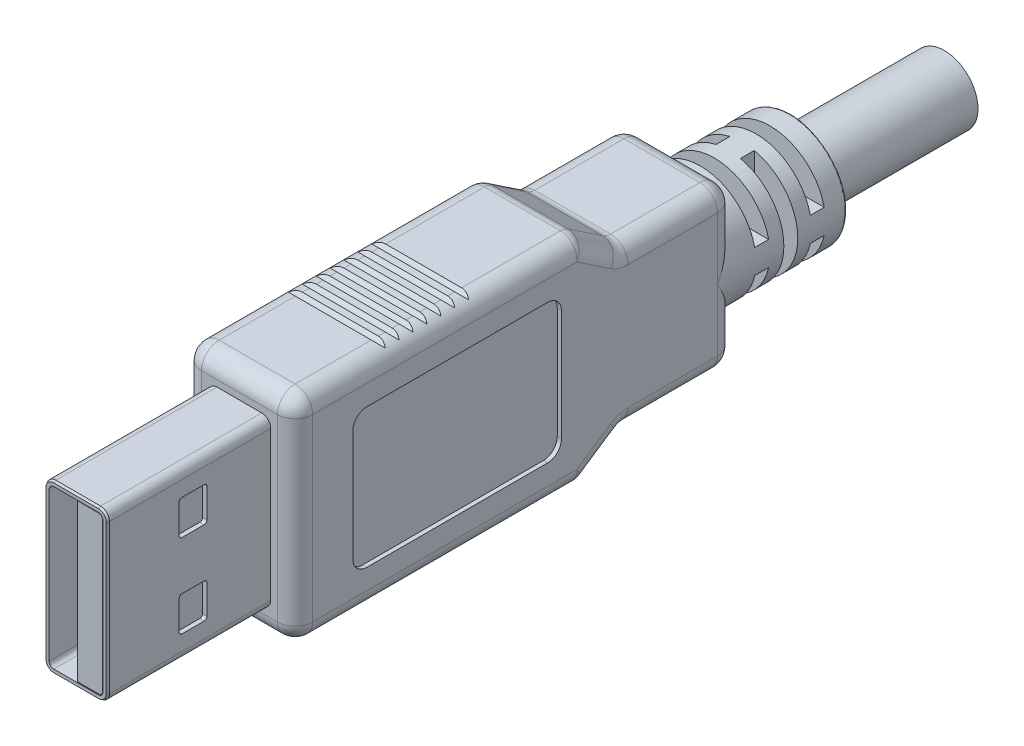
SolidWorks part; units mm, degrees
other "PartBody"
ref_plane "Front Plane" through (0, 0, 0) normal (0, 0, 1) x (1, 0, 0)
ref_plane "Top Plane" through (0, 0, 0) normal (0, 1, 0) x (1, 0, 0)
ref_plane "Right Plane" through (0, 0, 0) normal (1, 0, 0) x (0, 0, -1)
imported_body "Imported1"
sketch "Sketch1" plane through (0, 0, -15.83) normal (0, 0, -1) x (-1, 0, 0)
  circle A0 centre (-4, 0) radius 2.413
  dimension "D1" = 4.826
extrude "Boss-Extrude1" add sketch "Sketch1" along normal blind 19.05 separate body
